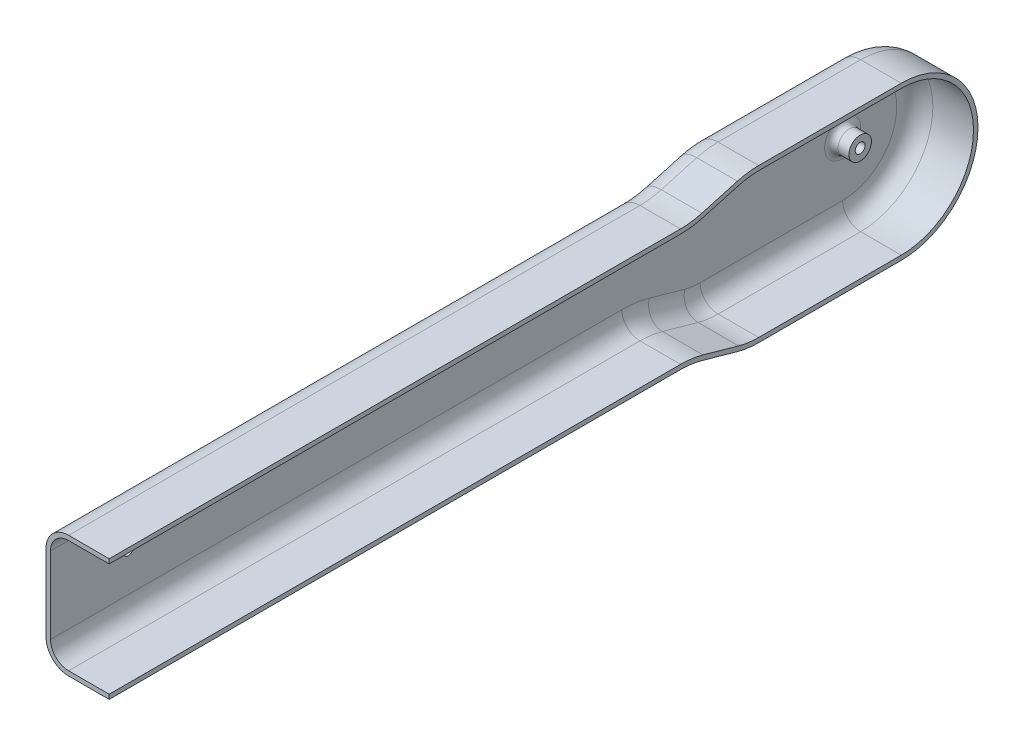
SolidWorks part; units mm, degrees
ref_plane "Front Plane" through (0, 0, 0) normal (1, 0, 0) x (0, 1, 0)
ref_plane "Top Plane" through (0, 0, 0) normal (0, 0, 1) x (0, 1, 0)
ref_plane "Right Plane" through (0, 0, 0) normal (0, 1, 0) x (-1, 0, 0)
sketch "Sketch1" plane through (0, 0, 0) normal (0, 0, 1) x (0, 1, 0)
  line L1 (-27, -14) -> (27, -14)
  line L2 (-27, -14) -> (-27, 14)
  line L3 (-27, 14) -> (27, 14)
  line L4 (27, -14) -> (27, 14)
  line L5 (-27, -14) -> (27, 14) construction
  line L6 (-27, 14) -> (27, -14) construction
  point P0 (0, 0)
  dimension "D1" = 54
  dimension "D2" = 28
extrude "Boss-Extrude1" add sketch "Sketch1" along normal blind 283
sketch "Sketch2" plane through (-14, 0, 0) normal (-1, 0, 0) x (0, -1, 0)
  line L2 (-34, 0) -> (-34, -68)
  line L4 (34, 0) -> (34, -68)
  line L5 (-34, 0) -> (34, -68) construction
  line L6 (-34, -68) -> (34, 0) construction
  line L8 (-34, 0) -> (-27, 25)
  line L9 (-27, 283) -> (-27, 0) construction
  line L10 (27, 25) -> (34, 0)
  line L11 (27, 283) -> (27, 0) construction
  line L12 (-27, 25) -> (27, 25)
  line L13 (-27, 0) -> (27, 0) construction
  arc A0 (-34, -68) -> (34, -68) centre (0, -68) ccw
  point P0 (0, -34)
  dimension "D1" = 68
  dimension "D2" = 68
  dimension "D3" = 25
extrude "Boss-Extrude2" add sketch "Sketch2" along direction (-1, 0, 0) on the side against the normal up to surface (28 mm away)
fillet "Fillet4" radius 35 4 edges at (0, -34, 0) (0, -27, 25) (0, 34, 0) (0, 27, 25)
fillet "Fillet5" radius 10 11 edges at (-14, -27, 156.4038) (-14, -27.3256, 25.0447) (-14, -30.5, 12.5) (-14, -33.6744, -0.0447) (-14, -34, -36.4038) (-14, 0, -102) (-14, 34, -36.4038) (-14, 33.6744, -0.0447) (-14, 30.5, 12.5) (-14, 27.3256, 25.0447) (-14, 27, 156.4038)
shell "Shell2" thickness 2
sketch "Sketch4" plane through (0, 0, 281) normal (0, 0, -1) x (1, 0, 0)
  line L8 (-12, 17) -> (-12, -17)
  line L9 (-4, -25) -> (14, -25)
  line L10 (14, -25) -> (14, 25)
  line L11 (14, 25) -> (-4, 25)
  line L12 (-12, 17) -> (-12, -17)
  line L13 (-4, -25) -> (14, -25)
  line L14 (14, -25) -> (14, 25)
  line L15 (14, 25) -> (-4, 25)
  arc A4 (-12, -17) -> (-4, -25) centre (-4, -17) ccw
  arc A5 (-4, 25) -> (-12, 17) centre (-4, 17) ccw
  arc A6 (-12, -17) -> (-4, -25) centre (-4, -17) ccw
  arc A7 (-4, 25) -> (-12, 17) centre (-4, 17) ccw
  dimension "D1" = 0
extrude "Cut-Extrude2" cut sketch "Sketch4" against normal through all
sketch "Sketch5" plane through (-14, 0, 0) normal (-1, 0, 0) x (0, -1, 0)
  line L0 (0, 283) -> (0, 248.5) construction
  line L1 (-17, 283) -> (17, 283) construction
  circle A0 centre (0, 248.5) radius 2.1
  dimension "D2" = 4.2
  dimension "D1" = 34.5
extrude "Cut-Extrude3" cut sketch "Sketch5" against normal through all
sketch "Sketch6" plane through (-12, 0, 0) normal (1, 0, 0) x (0, 1, 0)
  circle A0 centre (0, -68) radius 5
  dimension "D1" = 10
extrude "Boss-Extrude3" add sketch "Sketch6" along normal blind 7.8
fillet "Fillet6" radius 3 1 edges at (-12, 0, -73)
sketch "Sketch7" plane through (-4.2, 0, 0) normal (1, 0, 0) x (0, 1, 0)
  circle A0 centre (0, -68) radius 2.2
  dimension "D1" = 4.4
extrude "Cut-Extrude4" cut sketch "Sketch7" against normal through all
